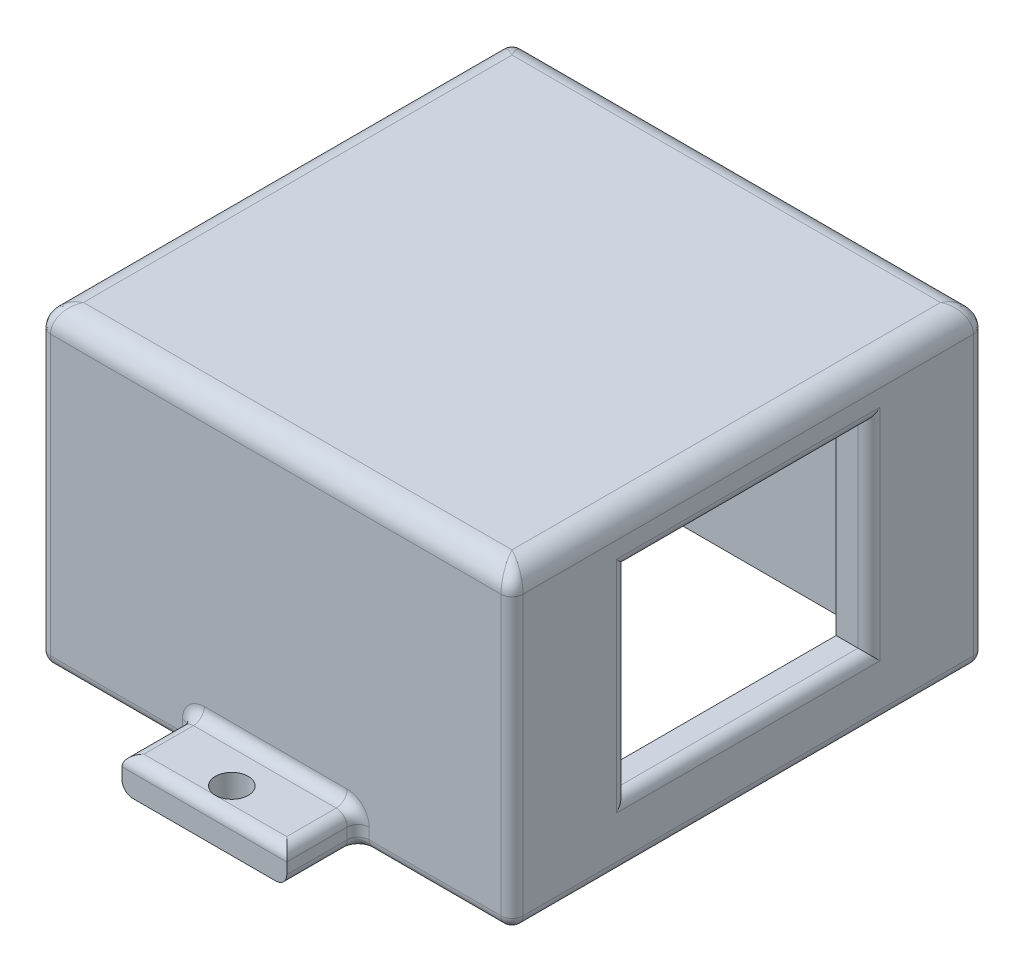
SolidWorks part; units mm, degrees
ref_plane "Front Plane" through (0, 0, 0) normal (0, 0, 1) x (1, 0, 0)
ref_plane "Top Plane" through (0, 0, 0) normal (0, 1, 0) x (1, 0, 0)
ref_plane "Right Plane" through (0, 0, 0) normal (1, 0, 0) x (0, 0, -1)
sketch "Sketch1" plane through (0, 0, 0) normal (0, 1, 0) x (1, 0, 0)
  line L0 (-3, 3) -> (40, 3)
  line L1 (0, 0) -> (37, 0)
  line L2 (0, 0) -> (0, -37)
  line L3 (0, -37) -> (37, -37)
  line L4 (37, 0) -> (37, -37)
  line L5 (40, 3) -> (40, -40)
  line L6 (-3, -40) -> (40, -40)
  line L7 (-3, 3) -> (-3, -40)
  dimension "D1" = 37
  dimension "D2" = 37
  dimension "D3" = 3
extrude "Boss-Extrude1" add sketch "Sketch1" along normal blind 28.35
sketch "Sketch2" plane through (0, 28.35, 0) normal (0, 1, 0) x (1, 0, 0)
  line L1 (-3, 3) -> (40, 3)
  line L2 (-3, 3) -> (-3, -40)
  line L3 (-3, -40) -> (40, -40)
  line L4 (40, 3) -> (40, -40)
extrude "Boss-Extrude2" add sketch "Sketch2" against normal blind 3
sketch "Sketch3" plane through (40, 0, 0) normal (1, 0, 0) x (0, 0, -1)
  line L0 (-40, 28.35) -> (3, 28.35) construction
  line L1 (-29.5, 23.85) -> (-7.5, 23.85)
  line L2 (-29.5, 23.85) -> (-29.5, 5.85)
  line L3 (-29.5, 5.85) -> (-7.5, 5.85)
  line L4 (-7.5, 23.85) -> (-7.5, 5.85)
  line L5 (-40, 28.35) -> (-40, 0) construction
  dimension "D1" = 22
  dimension "D2" = 18
  dimension "D3" = 4.5
  dimension "D4" = 10.5
extrude "Cut-Extrude1" cut sketch "Sketch3" against normal blind 4
sketch "Sketch4" plane through (0, 0, 0) normal (0, -1, 0) x (1, 0, 0)
  line L0 (18.5, -3) -> (18.5, 40.465) construction
  line L1 (40, -3) -> (-3, -3) construction
  line L2 (40, 18.5) -> (-3, 18.5) construction
  line L3 (40, 40) -> (40, -3) construction
  line L4 (-3, -3) -> (-3, 40) construction
  line L5 (-3, 40) -> (40, 40) construction
  line L6 (26, 40) -> (11, 40)
  line L7 (26, 40) -> (26, 46.5)
  line L8 (26, 46.5) -> (11, 46.5)
  line L9 (11, 40) -> (11, 46.5)
  line L10 (11, -3) -> (11, -9.5)
  line L11 (26, -9.5) -> (11, -9.5)
  line L12 (26, -3) -> (26, -9.5)
  line L13 (26, -3) -> (11, -3)
  line L15 (-3, 26) -> (-9.5, 26)
  line L16 (-3, 26) -> (-3, 11)
  line L17 (-3, 11) -> (-9.5, 11)
  line L18 (-9.5, 26) -> (-9.5, 11)
  dimension "D1" = 6.5
  dimension "D2" = 15
  dimension "D3" = 7.5
  dimension "D4" = 6.5
  dimension "D5" = 15
  dimension "D6" = 7.5
extrude "Boss-Extrude3" add sketch "Sketch4" against normal blind 3
sketch "Sketch5" plane through (0, 0, 0) normal (0, -1, 0) x (1, 0, 0)
  line L0 (18.5, 46.5) -> (18.5, -9.5) construction
  line L1 (26, 46.5) -> (11, 46.5) construction
  line L2 (11, -9.5) -> (26, -9.5) construction
  line L3 (-9.5, 18.5) -> (40, 18.5) construction
  line L4 (-9.5, 26) -> (-9.5, 11) construction
  line L5 (40, 40) -> (40, -3) construction
  line L6 (11, 40) -> (26, 40) construction
  circle A0 centre (18.5, 44) radius 1.5
  circle A1 centre (18.5, -7) radius 1.5
  circle A2 centre (-7, 18.5) radius 1.5
  dimension "D1" = 3
  dimension "D3" = 3
  dimension "D2" = 2.5
  dimension "D4" = 2.5
extrude "Cut-Extrude2" cut sketch "Sketch5" against normal blind 22.74
fillet "Fillet1" radius 2 4 edges at (-3, 28.35, 18.5) (18.5, 28.35, 40) (40, 28.35, 18.5) (18.5, 28.35, -3)
fillet "Fillet2" radius 1 12 edges at (11, 1.5, 40) (26, 1.5, 40) (26, 1.5, -3) (11, 1.5, -3) (11, 3, 43.25) (18.5, 3, 40) (18.5, 3, 46.5) (26, 3, 43.25) (18.5, 3, -3) (11, 3, -6.25) (26, 3, -6.25) (18.5, 3, -9.5)
fillet "Fillet3" radius 1 34 edges at (-6.25, 0, 26) (-6.25, 3, 26) (-6.25, 0, 11) (26, 0, 43.75) (26.2929, 0, 40.2929) (11, 0, 43.75) (10.7071, 0, 40.2929) (39.4142, 27.7642, 39.4142) (39.4142, 27.7642, -2.4142) (11, 0, -6.75) (10.7071, 0, -3.2929) (26, 0, -6.75) (26.2929, 0, -3.2929) (-2.4142, 27.7642, -2.4142) (-2.4142, 27.7642, 39.4142) (33.5, 0, 40) (3.5, 0, 40) (40, 0, 18.5) (40, 13.175, 40) (40, 14.85, 7.5) (40, 23.85, 18.5) (40, 14.85, 29.5) (40, 5.85, 18.5) (40, 13.175, -3) (3.5, 0, -3) (33.5, 0, -3) (-3, 0, 33) (-3, 1.5, 26) (-3, 3, 18.5) (-3, 1.5, 11) (-3, 0, 4) (-3, 13.175, -3) (-3, 13.175, 40) (-9.5, 3, 18.5)
